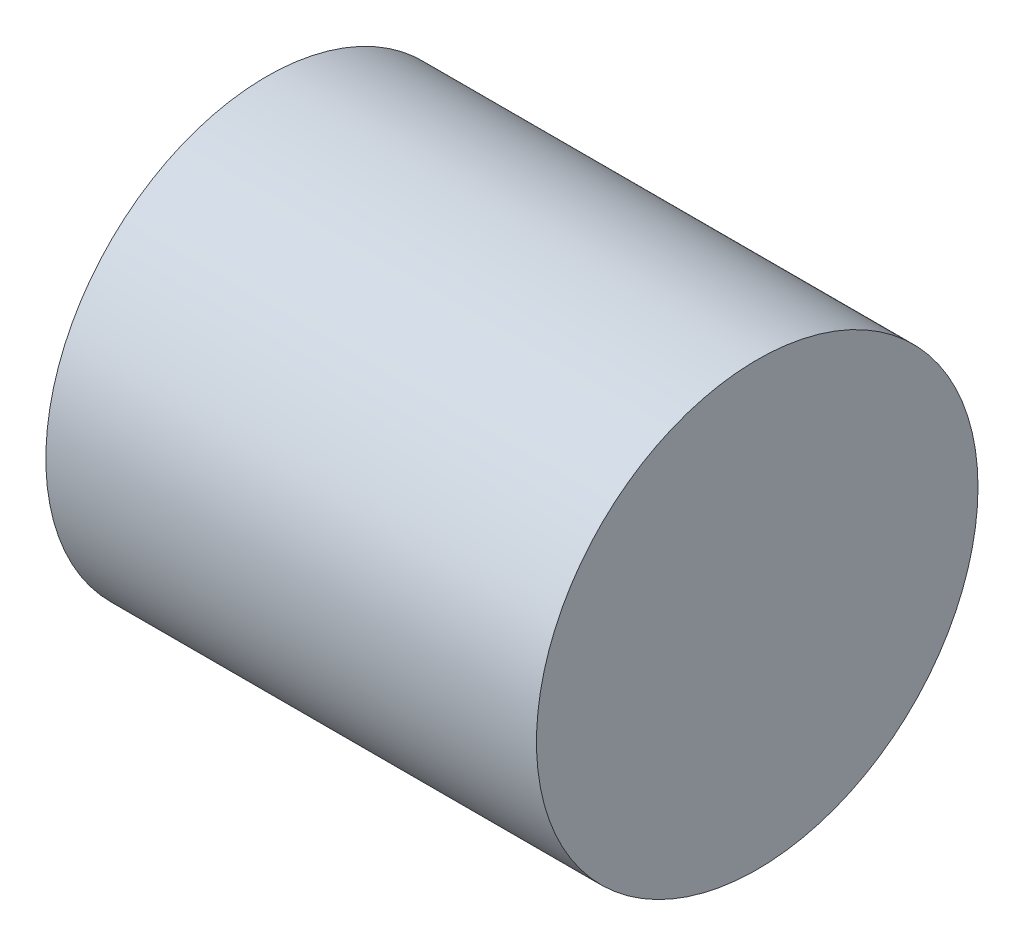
SolidWorks part; units mm, degrees
ref_plane "Front Plane" through (0, 0, 0) normal (0, 0, 1) x (1, 0, 0)
ref_plane "Top Plane" through (0, 0, 0) normal (0, 1, 0) x (1, 0, 0)
ref_plane "Right Plane" through (0, 0, 0) normal (1, 0, 0) x (0, 0, -1)
sketch "Sketch1" plane through (0, 0, 0) normal (1, 0, 0) x (0, 0, -1)
  circle A0 centre (0, 0) radius 9
  dimension "D1" = 18
extrude "Extrude1" add sketch "Sketch1" along normal blind 20
